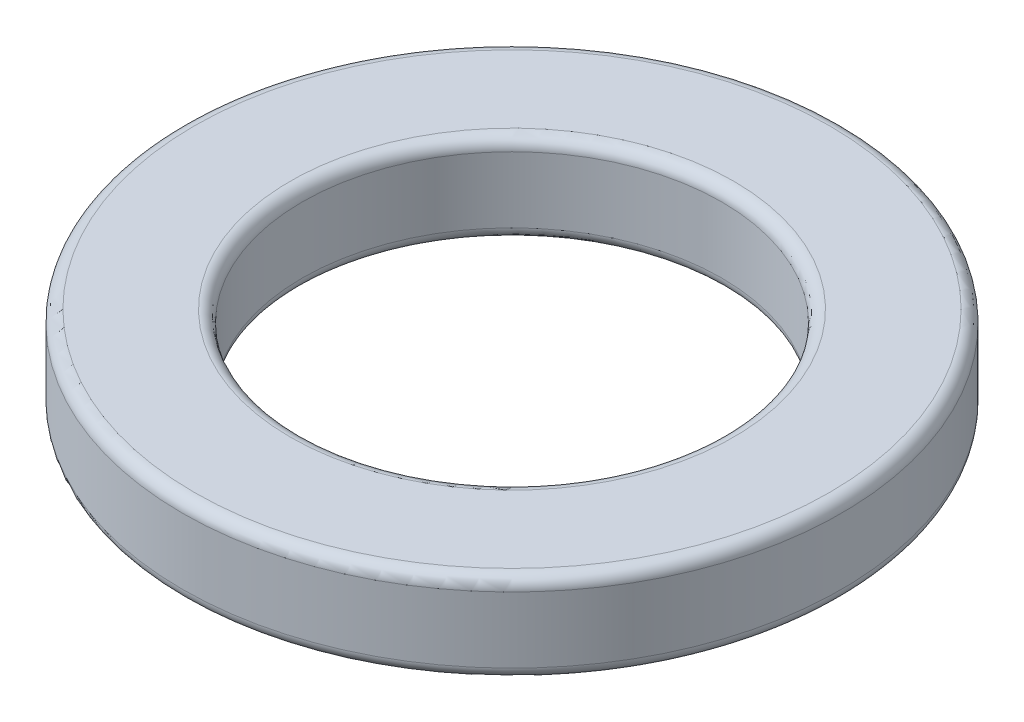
SolidWorks part; units mm, degrees
ref_plane "Face" through (0, 0, 0) normal (0, 0, 1) x (1, 0, 0)
ref_plane "Dessus" through (0, 0, 0) normal (0, 1, 0) x (1, 0, 0)
ref_plane "Profil" through (0, 0, 0) normal (1, 0, 0) x (0, 0, -1)
sketch "Esquisse1" plane through (0, 0, 0) normal (0, 0, 1) x (1, 0, 0)
  line L0 (0, 15.7889) -> (0, -5.894) construction
  line L2 (7, 0) -> (11, 0)
  line L3 (7, 0) -> (7, 3)
  line L4 (7, 3) -> (11, 3)
  line L5 (11, 0) -> (11, 3)
  dimension "D2" = 14
  dimension "D1" = 22
  dimension "D3" = 3
revolve "Base-Révolution" add sketch "Esquisse1" angle 360 about L0
fillet "Congé1" radius 0.4
